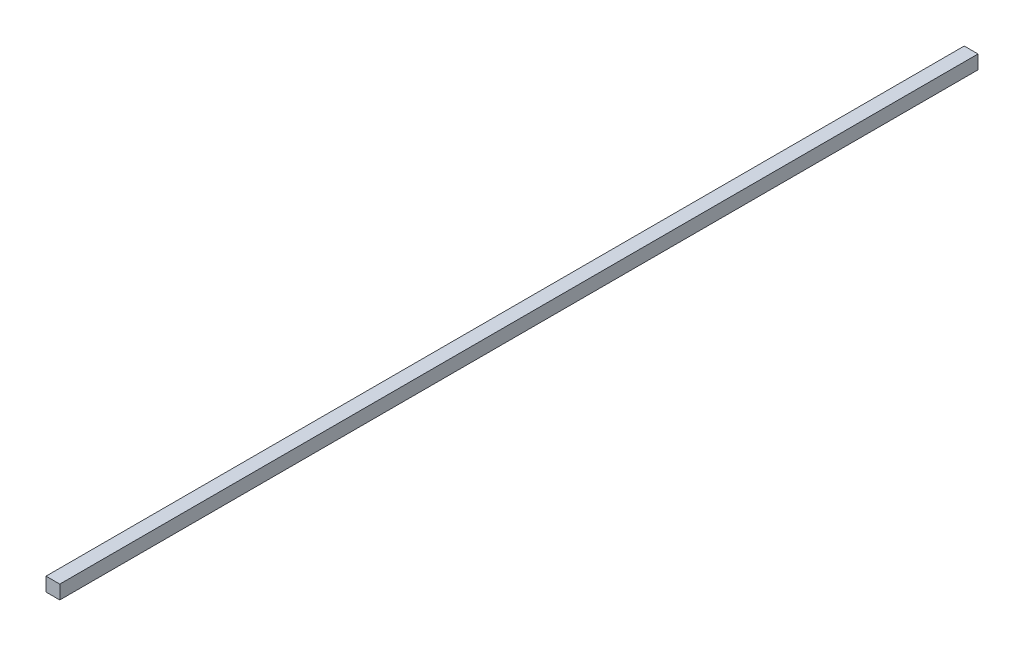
SolidWorks part; units mm, degrees
ref_plane "Face" through (0, 0, 0) normal (0, 0, 1) x (1, 0, 0)
ref_plane "Dessus" through (0, 0, 0) normal (0, 1, 0) x (1, 0, 0)
ref_plane "Droite" through (0, 0, 0) normal (1, 0, 0) x (0, 0, -1)
sketch "Esquisse1" plane through (0, 0, 0) normal (0, 0, 1) x (1, 0, 0)
  line L1 (0, 0) -> (3, 0)
  line L2 (0, 0) -> (0, 3)
  line L3 (0, 3) -> (3, 3)
  line L4 (3, 0) -> (3, 3)
  dimension "D1" = 3
  dimension "D2" = 3
extrude "Extrusion1" add sketch "Esquisse1" along normal blind 200
